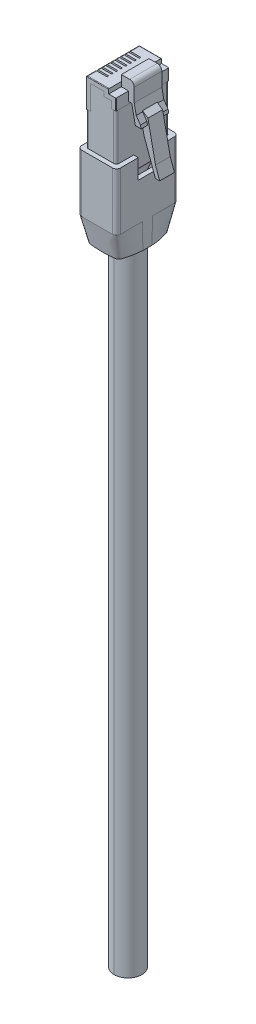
SolidWorks part; units mm, degrees
ref_plane "前基準面" through (0, 0, 0) normal (0, 0, 1) x (1, 0, 0)
ref_plane "上基準面" through (0, 0, 0) normal (0, 1, 0) x (1, 0, 0)
ref_plane "右基準面" through (0, 0, 0) normal (1, 0, 0) x (0, 0, -1)
imported_body "輸入1"
imported_body "輸入2"
imported_body "輸入3"
imported_body "輸入4"
imported_body "輸入5"
imported_body "輸入6"
imported_body "輸入7"
imported_body "輸入8"
imported_body "輸入9"
imported_body "輸入10"
imported_body "輸入11"
imported_body "輸入12"
imported_body "輸入13"
imported_body "輸入14"
imported_body "輸入15"
imported_body "輸入16"
imported_body "輸入17"
imported_body "輸入18"
imported_body "輸入19"
imported_body "輸入20"
imported_body "輸入21"
imported_body "輸入22"
imported_body "輸入23"
imported_body "輸入24"
imported_body "輸入25"
imported_body "輸入26"
imported_body "輸入27"
imported_body "輸入28"
split "分割1" bodies to split 116 resulting bodies 129 130 131
delete or keep bodies "本體-刪除/保留 1" type delete bodies bodies 131
ref_plane "平面1" through (0, 63.4761, 0) normal (0, 1, 0) x (1, 0, 0)
split "分割2" trim tools "平面1" bodies to split 130 resulting bodies 132 133
delete or keep bodies "本體-刪除/保留 2" type delete bodies bodies 133
delete or keep bodies "本體-刪除/保留 3" type delete bodies bodies 129
other "刪除面1"
other "刪除面2"
delete or keep bodies "本體-刪除/保留 4" type delete bodies bodies 120 109 125
delete or keep bodies "本體-刪除/保留 5" type delete bodies bodies 103 126 110 124 114 122 108 102 101 113
